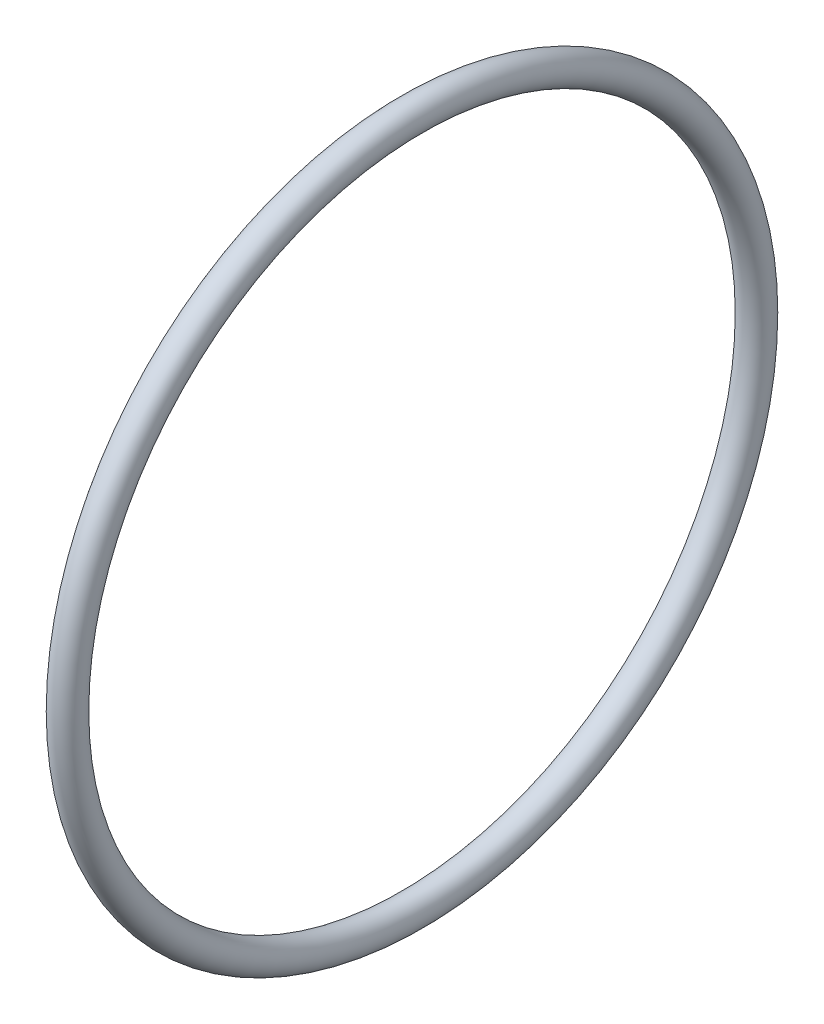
SolidWorks part; units mm, degrees
ref_plane "Face" through (0, 0, 0) normal (0, 0, 1) x (1, 0, 0)
ref_plane "Dessus" through (0, 0, 0) normal (0, 1, 0) x (1, 0, 0)
ref_plane "Droite" through (0, 0, 0) normal (1, 0, 0) x (0, 0, -1)
sketch "Esquisse1" plane through (0, 0, 0) normal (0, 0, 1) x (1, 0, 0)
  line L0 (-29.2362, -5.1535) -> (22.497, -5.1535) construction
  circle A0 centre (-5.2526, 74.8465) radius 3.495
  dimension "D1" = 6.99
  dimension "D2" = 80
revolve "Révolution1" add sketch "Esquisse1" angle 360 about L0
